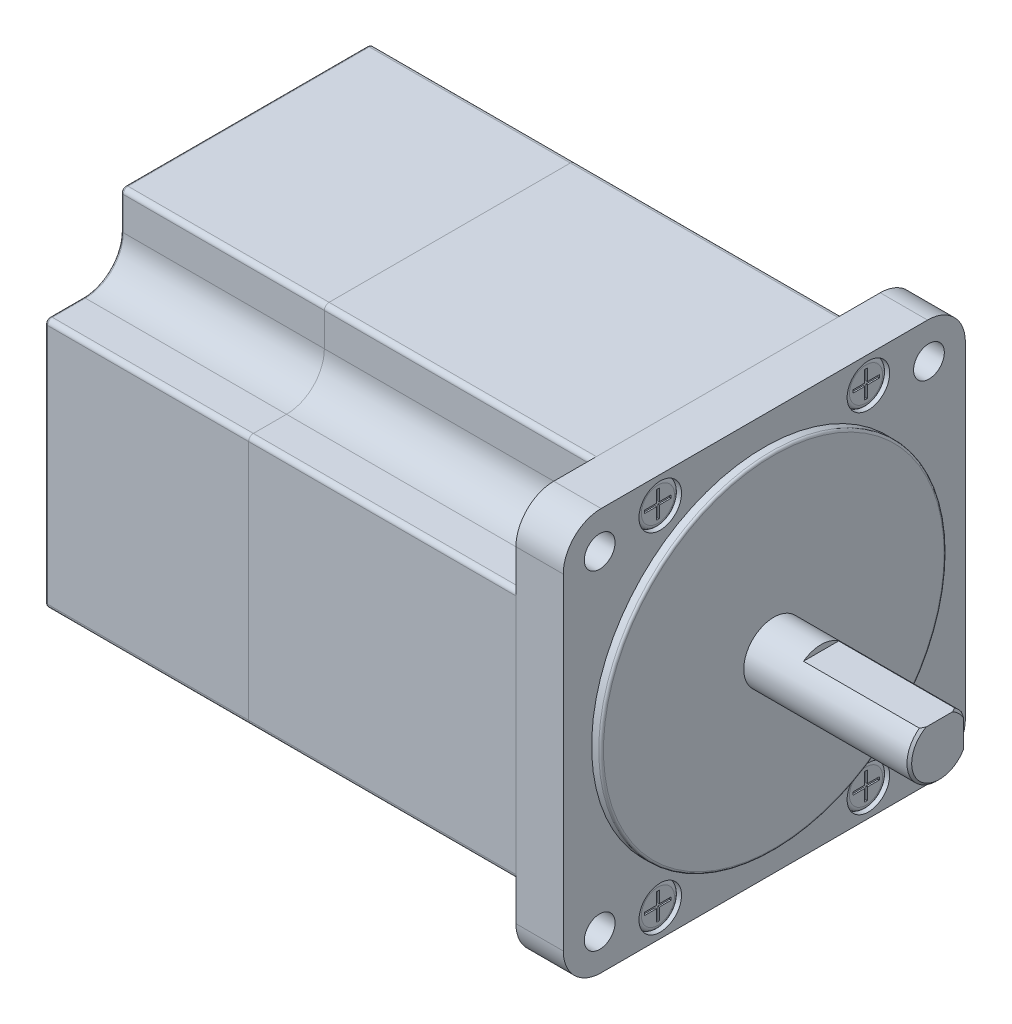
SolidWorks part; units mm, degrees
ref_plane "前视基准面" through (0, 0, 0) normal (0, 0, 1) x (1, 0, 0)
ref_plane "上视基准面" through (0, 0, 0) normal (0, 1, 0) x (1, 0, 0)
ref_plane "右视基准面" through (0, 0, 0) normal (1, 0, 0) x (0, 0, -1)
sketch "草图1" plane through (0, 0, 0) normal (1, 0, 0) x (0, 0, -1)
  line L2 (42.5, 34.5) -> (42.5, -34.5)
  line L3 (34.5, -42.5) -> (-34.5, -42.5)
  line L4 (-42.5, -34.5) -> (-42.5, 34.5)
  line L5 (-34.5, 42.5) -> (34.5, 42.5)
  arc A0 (-42.5, -34.5) -> (-34.5, -42.5) centre (-34.5, -34.5) ccw
  arc A1 (34.5, -42.5) -> (42.5, -34.5) centre (34.5, -34.5) ccw
  arc A2 (42.5, 34.5) -> (34.5, 42.5) centre (34.5, 34.5) ccw
  arc A3 (-42.5, 34.5) -> (-34.5, 42.5) centre (-34.5, 34.5) cw
  dimension "D1" = 8
extrude "凸台-拉伸1" add sketch "草图1" against normal blind 10
sketch "草图2" plane through (-10, 0, 0) normal (-1, 0, 0) x (0, 0, 1)
  line L0 (26.5, -34.5) -> (26.5, -41.5)
  line L1 (34.5, -42.5) -> (-34.5, -42.5) construction
  line L2 (-26.5, -42.5) -> (25.5, -42.5)
  line L3 (42.5, -25.5) -> (42.5, 25.5)
  line L4 (25.5, 42.5) -> (-25.5, 42.5)
  line L5 (42.5, 34.5) -> (42.5, -34.5) construction
  line L6 (41.5, -26.5) -> (34.5, -26.5)
  line L7 (-42.5, 25.5) -> (-42.5, -25.5)
  line L8 (34.5, 26.5) -> (41.5, 26.5)
  line L12 (-34.5, 42.5) -> (34.5, 42.5) construction
  line L13 (26.5, 41.5) -> (26.5, 34.5)
  line L15 (-26.5, 34.5) -> (-26.5, 41.5)
  line L19 (-42.5, -34.5) -> (-42.5, 34.5) construction
  line L20 (-41.5, 26.5) -> (-34.5, 26.5)
  line L22 (-34.5, -26.5) -> (-41.5, -26.5)
  line L26 (-26.5, -42.5) -> (-26.5, -34.5)
  arc A0 (25.5, -42.5) -> (26.5, -41.5) centre (25.5, -41.5) ccw
  arc A1 (-34.5, 26.5) -> (-26.5, 34.5) centre (-34.5, 34.5) ccw
  arc A2 (26.5, 34.5) -> (34.5, 26.5) centre (34.5, 34.5) ccw
  arc A3 (34.5, -26.5) -> (26.5, -34.5) centre (34.5, -34.5) ccw
  arc A4 (-26.5, -34.5) -> (-34.5, -26.5) centre (-34.5, -34.5) ccw
  arc A5 (41.5, -26.5) -> (42.5, -25.5) centre (41.5, -25.5) ccw
  arc A6 (42.5, 25.5) -> (41.5, 26.5) centre (41.5, 25.5) ccw
  arc A7 (25.5, 42.5) -> (26.5, 41.5) centre (25.5, 41.5) cw
  arc A8 (-25.5, 42.5) -> (-26.5, 41.5) centre (-25.5, 41.5) ccw
  arc A9 (-41.5, 26.5) -> (-42.5, 25.5) centre (-41.5, 25.5) ccw
  arc A10 (-42.5, -25.5) -> (-41.5, -26.5) centre (-41.5, -25.5) ccw
  point P7 (26.5, -42.5)
  point P17 (42.5, -26.5)
  point P34 (42.5, 26.5)
  point P45 (26.5, 42.5)
  point P51 (-26.5, 42.5)
  point P54 (-42.5, 26.5)
  point P57 (-42.5, -26.5)
  dimension "D1" = 1
extrude "凸台-拉伸2" add sketch "草图2" along normal blind 56.5 separate body
sketch "草图3" plane through (-66.5, 0, 0) normal (-1, 0, 0) x (0, 0, 1)
  line L0 (-26.5, -42.5) -> (-26.5, -41.5)
  line L1 (-26.5, -34.5) -> (-26.5, -42.5) construction
  line L3 (-26.5, -42.5) -> (-25.5, -42.5)
  arc A0 (-26.5, -41.5) -> (-25.5, -42.5) centre (-25.5, -41.5) ccw
extrude "切除-拉伸1" cut sketch "草图3" against normal blind 56.5
sketch "草图4" plane through (0, 0, 0) normal (1, 0, 0) x (0, 0, -1)
  circle A0 centre (0, 0) radius 36.5
extrude "凸台-拉伸3" add sketch "草图4" along normal blind 2
sketch "草图5" plane through (2, 0, 0) normal (1, 0, 0) x (0, 0, -1)
  circle A0 centre (0, 0) radius 6.35
extrude "凸台-拉伸4" add sketch "草图5" along normal blind 35
chamfer "倒角1" distance 0.5 angle 45 1 edges at (37, 0, -6.35)
sketch "草图6" plane through (37, 0, 0) normal (1, 0, 0) x (0, 0, -1)
  line L2 (3.7148, 5.15) -> (-3.7148, 5.15)
  line L3 (5.15, 3.7148) -> (5.15, -3.7148)
  arc A0 (5.15, -3.7148) -> (-3.7148, 5.15) centre (0, 0) ccw
extrude "切除-拉伸2" cut sketch "草图6" against normal blind 25 contours L3 M1 | L3 A0 M1 | L2 A0 M1 | L2 M1
sketch "草图8" plane through (0, 0, 0) normal (1, 0, 0) x (0, 0, -1)
  circle A0 centre (-34.8, 34.8) radius 3.25
  circle A1 centre (34.8, 34.8) radius 3.25
  circle A2 centre (34.8, -34.8) radius 3.25
  circle A3 centre (-34.8, -34.8) radius 3.25
extrude "切除-拉伸3" cut sketch "草图8" against normal blind 10
sketch "草图9" plane through (0, 0, 0) normal (1, 0, 0) x (0, 0, -1)
  circle A0 centre (22, -36.8) radius 4.5
  circle A1 centre (-22, -36.8) radius 4.5
  circle A2 centre (22, 36.8) radius 4.5
  circle A3 centre (-22, 36.8) radius 4.5
extrude "切除-拉伸5" cut sketch "草图9" against normal blind 1.5
sketch "草图13" plane through (-1.5, 0, 0) normal (1, 0, 0) x (0, 0, -1)
  circle A0 centre (-22, -36.8) radius 4.5
  circle A1 centre (22, 36.8) radius 4.5
  circle A2 centre (-22, 36.8) radius 4.5
  circle A3 centre (22, -36.8) radius 4.5
extrude "凸台-拉伸6" add sketch "草图13" along normal blind 1 separate body
fillet "圆角2" radius 1 1 edges at (-0.5, -36.8, -26.5)
fillet "圆角3" radius 1 1 edges at (-0.5, -36.8, 17.5)
fillet "圆角4" radius 1 1 edges at (-0.5, 36.8, 17.5)
fillet "圆角5" radius 1 1 edges at (-0.5, 36.8, -26.5)
sketch "草图14" plane through (-0.5, 0, 0) normal (1, 0, 0) x (0, 0, -1)
  line L0 (21.7, 36.5) -> (21.7, 33.9975)
  line L1 (22.3, 36.5) -> (24.7962, 36.5)
  line L4 (-22.3, 37.1) -> (-24.8, 37.1)
  line L5 (-24.8, 37.1) -> (-24.8, 36.5)
  line L6 (-24.8, 36.5) -> (-22.3, 36.5)
  line L7 (-19.2, 36.5) -> (-19.2, 37.1)
  line L8 (-19.2, 37.1) -> (-21.7, 37.1)
  line L10 (-21.7, 39.5968) -> (-22.3, 39.5968)
  line L11 (-22.3, 39.5968) -> (-22.3, 37.1)
  line L12 (-22.3, 33.9975) -> (-21.7, 33.9975)
  line L13 (-21.7, 33.9975) -> (-21.7, 36.5)
  line L18 (21.7, 37.1) -> (19.1955, 37.1)
  line L19 (19.1955, 37.1) -> (19.1955, 36.5)
  line L20 (19.1955, 36.5) -> (21.7, 36.5)
  line L21 (24.7962, 36.5) -> (24.7962, 37.1)
  line L22 (24.7962, 37.1) -> (22.3, 37.1)
  line L23 (22.3, 37.1) -> (22.3, 39.5968)
  line L24 (22.3, 39.5968) -> (21.7, 39.5968)
  line L25 (21.7, 39.5968) -> (21.7, 37.1)
  line L26 (21.7, 33.9975) -> (22.3, 33.9975)
  line L27 (22.3, 33.9975) -> (22.3, 36.5)
  line L28 (-21.7, 37.1) -> (-21.7, 39.5968)
  line L29 (-22.3, 36.5) -> (-22.3, 33.9975)
  line L30 (-21.7, 36.5) -> (-19.2, 36.5)
  line L32 (21.7, -36.5) -> (21.7, -34.0041)
  line L33 (21.7, -34.0041) -> (22.3, -34.0041)
  line L34 (22.3, -34.0041) -> (22.3, -36.5)
  line L35 (22.3, -39.6066) -> (21.7, -39.6066)
  line L36 (21.7, -39.6066) -> (21.7, -37.1)
  line L37 (21.7, -37.1) -> (19.1955, -37.1)
  line L38 (19.1955, -37.1) -> (19.1955, -36.5)
  line L39 (19.1955, -36.5) -> (21.7, -36.5)
  line L40 (24.7962, -36.5) -> (24.7962, -37.1)
  line L41 (24.7962, -37.1) -> (22.3, -37.1)
  line L42 (22.3, -37.1) -> (22.3, -39.6066)
  line L43 (22.3, -36.5) -> (24.7962, -36.5)
  line L47 (-21.7, -37.1) -> (-19.2, -37.1)
  line L48 (-19.2, -37.1) -> (-19.2, -36.5)
  line L49 (-19.2, -36.5) -> (-21.7, -36.5)
  line L50 (-24.8, -36.5) -> (-24.8, -37.1)
  line L51 (-24.8, -37.1) -> (-22.3, -37.1)
  line L52 (-22.3, -37.1) -> (-22.3, -39.6066)
  line L53 (-22.3, -39.6066) -> (-21.7, -39.6066)
  line L54 (-21.7, -39.6066) -> (-21.7, -37.1)
  line L55 (-21.7, -34.0041) -> (-22.3, -34.0041)
  line L56 (-22.3, -34.0041) -> (-22.3, -36.5)
  line L58 (-21.7, -36.5) -> (-21.7, -34.0041)
  line L59 (-22.3, -36.5) -> (-24.8, -36.5)
extrude "切除-拉伸6" cut sketch "草图14" against normal blind 0.3
sketch "草图15" plane through (-66.5, 0, 0) normal (-1, 0, 0) x (0, 0, 1)
  line L1 (-25.5, -42.5) -> (25.5, -42.5)
  line L2 (-42.5, -25.5) -> (-42.5, 25.5)
  line L3 (-26.5, -34.5) -> (-26.5, -41.5)
  line L4 (42.5, -25.5) -> (42.5, 25.5)
  line L5 (-41.5, -26.5) -> (-34.5, -26.5)
  line L9 (26.5, -41.5) -> (26.5, -34.5)
  line L11 (34.5, -26.5) -> (41.5, -26.5)
  line L13 (41.5, 26.5) -> (34.5, 26.5)
  line L15 (26.5, 34.5) -> (26.5, 41.5)
  line L16 (-26.5, 41.5) -> (-26.5, 34.5)
  line L18 (-34.5, 26.5) -> (-41.5, 26.5)
  line L19 (-25.5, 42.5) -> (25.5, 42.5)
  arc A0 (-34.5, 26.5) -> (-26.5, 34.5) centre (-34.5, 34.5) ccw
  arc A1 (-26.5, -41.5) -> (-25.5, -42.5) centre (-25.5, -41.5) ccw
  arc A2 (34.5, -26.5) -> (26.5, -34.5) centre (34.5, -34.5) ccw
  arc A3 (-26.5, -34.5) -> (-34.5, -26.5) centre (-34.5, -34.5) ccw
  arc A4 (-41.5, 26.5) -> (-42.5, 25.5) centre (-41.5, 25.5) ccw
  arc A5 (-25.5, 42.5) -> (-26.5, 41.5) centre (-25.5, 41.5) ccw
  arc A6 (26.5, 41.5) -> (25.5, 42.5) centre (25.5, 41.5) ccw
  arc A7 (42.5, 25.5) -> (41.5, 26.5) centre (41.5, 25.5) ccw
  arc A8 (41.5, -26.5) -> (42.5, -25.5) centre (41.5, -25.5) ccw
  arc A9 (25.5, -42.5) -> (26.5, -41.5) centre (25.5, -41.5) ccw
  arc A11 (-42.5, -25.5) -> (-41.5, -26.5) centre (-41.5, -25.5) ccw
  arc A12 (26.5, 34.5) -> (34.5, 26.5) centre (34.5, 34.5) ccw
  point P0 (0, 0)
extrude "凸台-拉伸7" add sketch "草图15" along normal blind 43 separate body
fillet "圆角6" radius 0.5 24 edges at (-109.5, 26.5, -38) (-109.5, 28.8431, -28.8431) (-109.5, 38, -26.5) (-109.5, 42.2071, -26.2071) (-109.5, 42.5, 0) (-109.5, 42.2071, 26.2071) (-109.5, 38, 26.5) (-109.5, 28.8431, 28.8431) (-109.5, 26.5, 38) (-109.5, 26.2071, 42.2071) (-109.5, 0, 42.5) (-109.5, -26.2071, 42.2071) (-109.5, -26.5, 38) (-109.5, -28.8431, 28.8431) (-109.5, -38, 26.5) (-109.5, -42.2071, 26.2071) (-109.5, -42.5, 0) (-109.5, -42.2071, -26.2071) (-109.5, -38, -26.5) (-109.5, -28.8431, -28.8431) (-109.5, -26.5, -38) (-109.5, -26.2071, -42.2071) (-109.5, 0, -42.5) (-109.5, 26.2071, -42.2071)
fillet "圆角7" radius 0.5 1 edges at (2, 0, -36.5)
